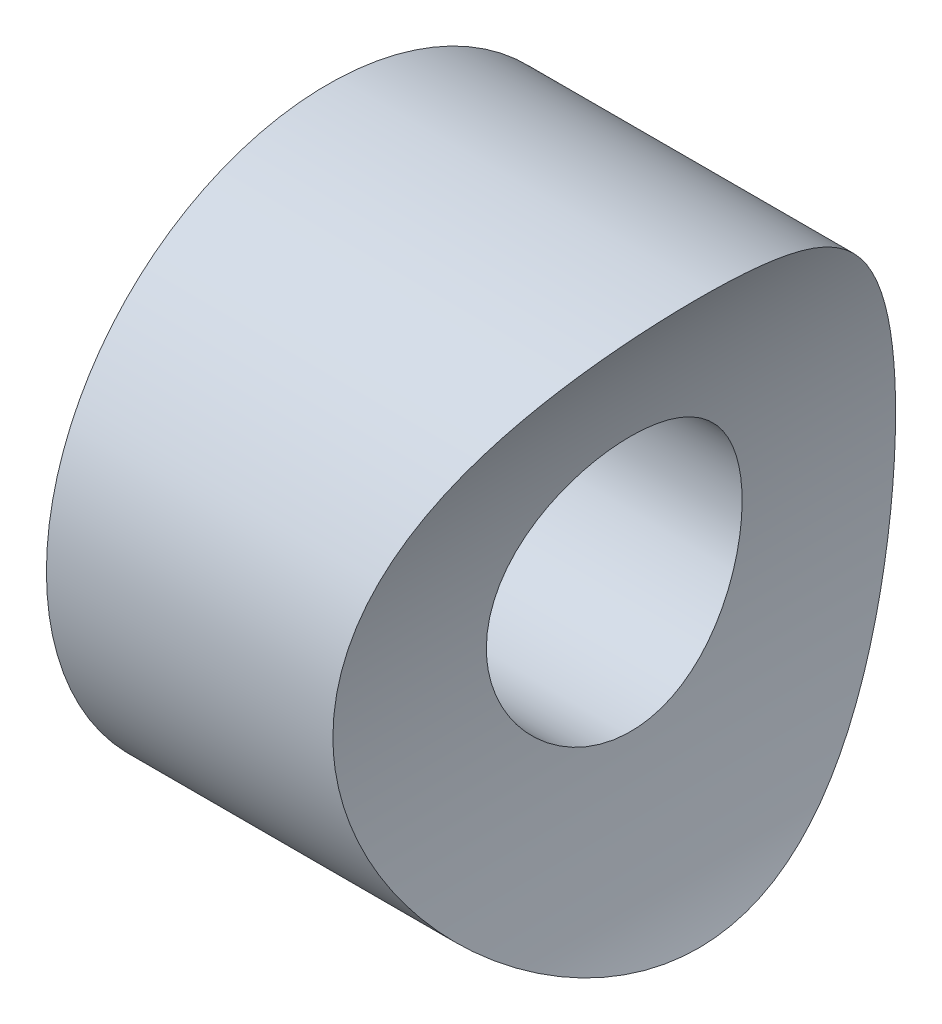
SolidWorks part; units mm, degrees
ref_plane "前视基准面" through (0, 0, 0) normal (0, 0, 1) x (1, 0, 0)
ref_plane "上视基准面" through (0, 0, 0) normal (0, 1, 0) x (1, 0, 0)
ref_plane "右视基准面" through (0, 0, 0) normal (1, 0, 0) x (0, 0, -1)
sketch "草图1" plane through (0, 0, 0) normal (1, 0, 0) x (0, 0, -1)
  circle A0 centre (0, 0) radius 12.5
  circle A1 centre (0, 0) radius 27.5
  dimension "D1" = 25
  dimension "D2" = 55
extrude "拉伸1" add sketch "草图1" along normal blind 40
sketch "草图2" plane through (0, 0, 0) normal (0, 0, 1) x (1, 0, 0)
  circle A0 centre (78, 0) radius 50
  dimension "D1" = 100
  dimension "D2" = 78
extrude "切除-拉伸1" cut sketch "草图2" against normal mid plane 70
